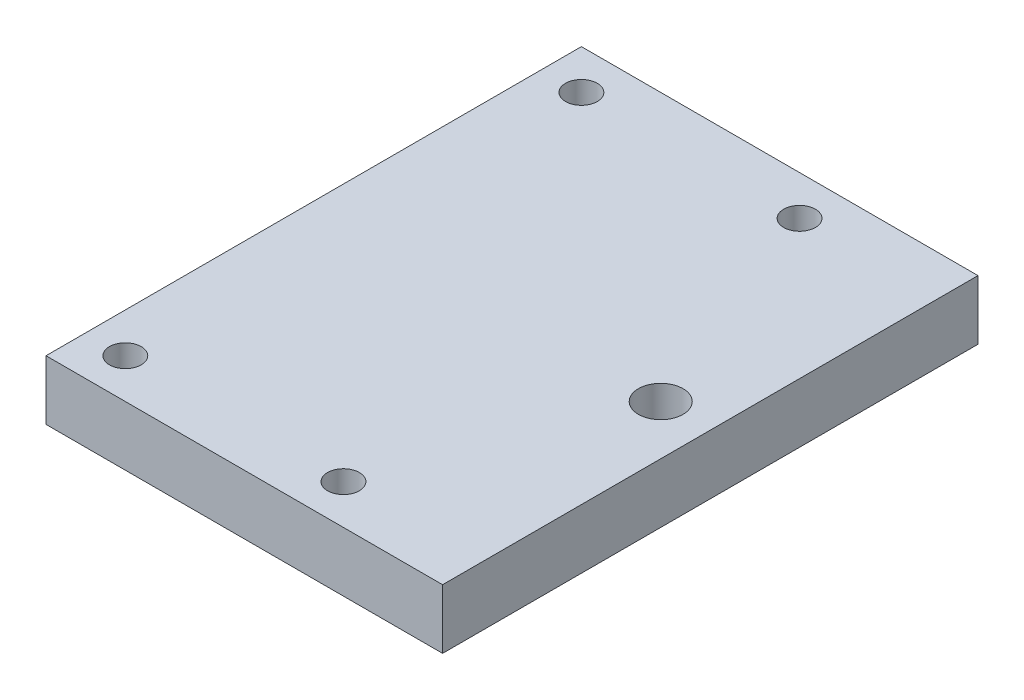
SolidWorks part; units mm, degrees
ref_plane "Plan de face" through (0, 0, 0) normal (0, 0, 1) x (1, 0, 0)
ref_plane "Plan de dessus" through (0, 0, 0) normal (0, 1, 0) x (1, 0, 0)
ref_plane "Plan de droite" through (0, 0, 0) normal (1, 0, 0) x (0, 0, -1)
sketch "Esquisse2" plane through (0, 0, 0) normal (0, 1, 0) x (1, 0, 0)
  line L0 (-3.7147, 54) -> (37.2981, 54) construction
  line L1 (0, 0) -> (30, 0)
  line L2 (0, 0) -> (0, 54)
  line L3 (0, 54) -> (30, 54)
  line L4 (30, 0) -> (30, 54)
  line L10 (0, 55.1911) -> (0, 37.1099) construction
  circle A26 centre (4.0005, 49.9999) radius 1.6002
  circle A27 centre (25.9994, 49.9999) radius 1.6002
  circle A28 centre (4.0005, 4.0005) radius 1.6002
  circle A30 centre (25.9994, 4.0005) radius 1.6002
extrude "Extrusion1" add sketch "Esquisse2" along normal blind 6
sketch "Esquisse3" plane through (30, 0, 0) normal (1, 0, 0) x (0, 0, -1)
  line L1 (0, 0) -> (54, 0)
  line L2 (0, 0) -> (0, 6)
  line L3 (0, 6) -> (54, 6)
  line L4 (54, 0) -> (54, 6)
extrude "Extrusion2" add sketch "Esquisse3" along normal blind 10
sketch "Esquisse4" plane through (0, 6, 0) normal (0, 1, 0) x (-1, 0, 0)
  line L0 (-40, -27) -> (0, -27) construction
  line L1 (-40, -54) -> (-40, 0) construction
  line L2 (0, -54) -> (0, 0) construction
  circle A0 centre (-35, -27) radius 2.25
  dimension "D1" = 4.5
  dimension "D2" = 5
extrude "Enlèv. mat.-Extru.1" cut sketch "Esquisse4" against normal through all
